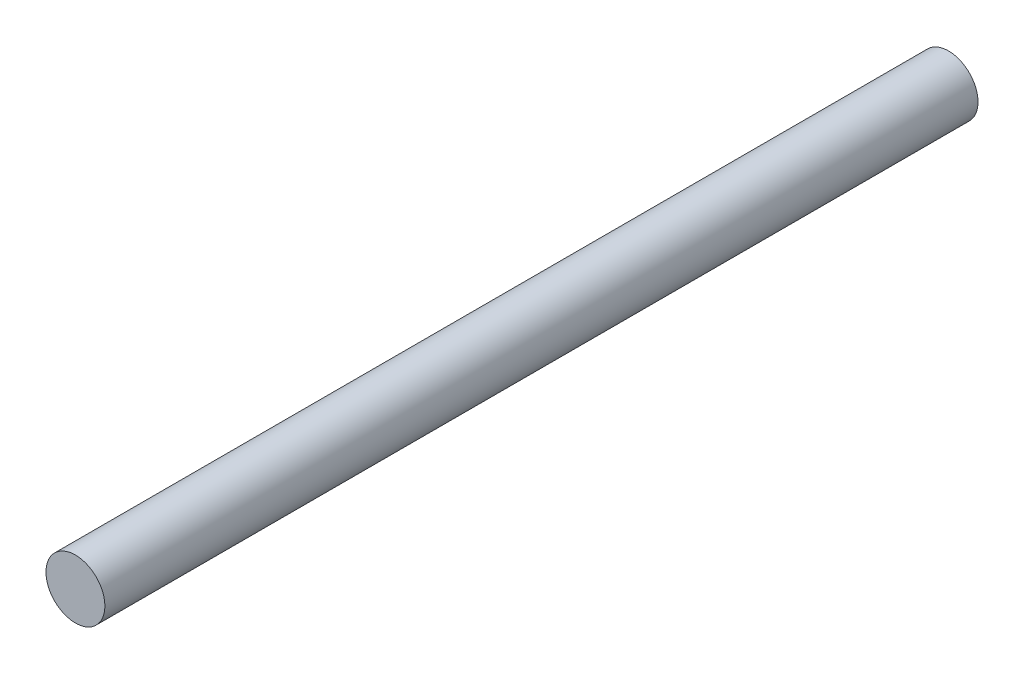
SolidWorks part; units mm, degrees
ref_plane "Front Plane" through (0, 0, 0) normal (0, 0, 1) x (1, 0, 0)
ref_plane "Top Plane" through (0, 0, 0) normal (0, 1, 0) x (1, 0, 0)
ref_plane "Right Plane" through (0, 0, 0) normal (1, 0, 0) x (0, 0, -1)
sketch "Sketch1" plane through (0, 0, 0) normal (0, 0, 1) x (1, 0, 0)
  circle A0 centre (-2.0559, -3.8735) radius 0.6858
  point P2 (-2.0559, -3.8735)
  dimension "D1" = 1.3716
extrude "Boss-Extrude1" add sketch "Sketch1" against normal blind 17.78 and the other way blind 2.54
